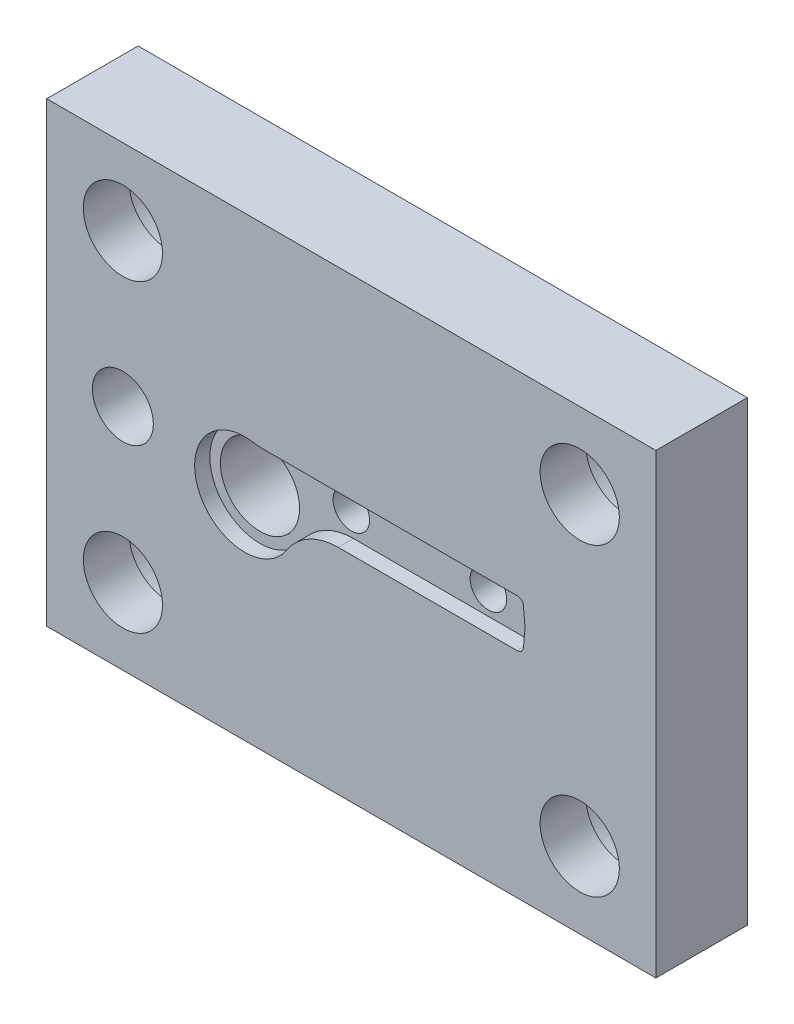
SolidWorks part; units mm, degrees
ref_plane "Plan1" through (0, 0, 0) normal (0, 0, 1) x (1, 0, 0)
ref_plane "Plan2" through (0, 0, 0) normal (0, 1, 0) x (1, 0, 0)
ref_plane "Plan3" through (0, 0, 0) normal (1, 0, 0) x (0, 0, -1)
sketch "Esquisse1" plane through (0, 0, 0) normal (0, 0, 1) x (1, 0, 0)
  line L1 (0, 0) -> (200, 0)
  line L2 (0, 0) -> (0, 150)
  line L3 (0, 150) -> (200, 150)
  line L4 (200, 0) -> (200, 150)
  dimension "D1" = 150
  dimension "D2" = 200
extrude "Base-Extrusion" add sketch "Esquisse1" along normal blind 30
sketch "Esquisse2" plane through (0, 0, 30) normal (0, 0, 1) x (1, 0, 0)
  line L0 (-10, 70) -> (90, 70) construction
  line L1 (0, 0) -> (200, 0) construction
  line L2 (20.3045, 78.12) -> (209.4484, 78.12) construction
  line L3 (71.0782, 85.935) -> (154.4898, 85.935)
  line L4 (156.5121, 84.0819) -> (157.0337, 78.12)
  line L5 (156.5121, 72.1581) -> (157.0337, 78.12)
  line L6 (95.6814, 70.305) -> (154.4898, 70.305)
  line L7 (200, 0) -> (200, 150) construction
  arc A0 (67.7404, 86.2151) -> (78.8329, 61.1069) centre (65, 70) ccw
  arc A1 (154.4898, 85.935) -> (156.5121, 84.0819) centre (154.4898, 83.905) cw
  arc A2 (71.0782, 85.935) -> (67.7404, 86.2151) centre (71.0782, 105.965) cw
  arc A3 (154.4898, 70.305) -> (156.5121, 72.1581) centre (154.4898, 72.335) ccw
  arc A4 (95.6814, 70.305) -> (78.8329, 61.1069) centre (95.6814, 50.275) ccw
  point P13 (156.35, 85.935)
  dimension "D2" = 32.89
  dimension "D6" = 91.35
  dimension "D7" = 2.03
  dimension "D8" = 20.03
  dimension "D9" = 20.03
  dimension "D10" = 135
  dimension "D1" = 70
  dimension "D3" = 8.12
  dimension "D4" = 7.815
  dimension "D5" = 95
extrude "Enlèv. mat.-Extru.1" cut sketch "Esquisse2" against normal blind 5
sketch "Esquisse3" plane through (0, 0, 25) normal (0, 0, 1) x (1, 0, 0)
  circle A0 centre (65, 70) radius 13
  dimension "D1" = 26
extrude "Enlèv. mat.-Extru.2" cut sketch "Esquisse3" against normal through all
sketch "Esquisse6" plane through (0, 0, 25) normal (0, 0, 1) x (1, 0, 0)
  line L0 (177.0279, 78.12) -> (94.3195, 78.12) construction
  line L1 (200, 0) -> (200, 150) construction
  circle A0 centre (140, 78.12) radius 6
  circle A1 centre (95, 78.12) radius 6
  dimension "D1" = 45
  dimension "D2" = 60
  dimension "D3" = 12
  dimension "D4" = 12
extrude "Enlèv. mat.-Extru.5" cut sketch "Esquisse6" against normal blind 13
sketch "Esquisse7" plane through (0, 0, 12) normal (0, 0, 1) x (1, 0, 0)
  circle A0 centre (140, 78.12) radius 9
  circle A1 centre (95, 78.12) radius 9
  dimension "D1" = 18
  dimension "D2" = 18
extrude "Enlèv. mat.-Extru.6" cut sketch "Esquisse7" against normal through all
sketch "Esquisse8" plane through (0, 0, 30) normal (0, 0, 1) x (1, 0, 0)
  line L1 (200, 0) -> (200, 150) construction
  line L2 (0, 0) -> (200, 0) construction
  circle A0 centre (25, 125) radius 13
  circle A1 centre (25, 25) radius 13
  circle A2 centre (175, 25) radius 13
  circle A3 centre (175, 125) radius 13
  dimension "D1" = 26
  dimension "D2" = 26
  dimension "D3" = 26
  dimension "D4" = 26
  dimension "D5" = 150
  dimension "D6" = 25
  dimension "D8" = 150
  dimension "D10" = 100
  dimension "D11" = 100
  dimension "D12" = 25
  dimension "D7" = 25
  dimension "D9" = 25
extrude "Enlèv. mat.-Extru.7" cut sketch "Esquisse8" against normal blind 15
sketch "Esquisse9" plane through (0, 0, 15) normal (0, 0, 1) x (1, 0, 0)
  circle A0 centre (25, 125) radius 20
  circle A1 centre (175, 125) radius 20
  circle A2 centre (175, 25) radius 20
  circle A3 centre (25, 25) radius 20
  dimension "D1" = 40
  dimension "D2" = 40
  dimension "D3" = 40
  dimension "D4" = 40
extrude "Enlèv. mat.-Extru.8" cut sketch "Esquisse9" against normal through all
hole_wizard "Chambrage pour vis à tête hexagonale M41" positions "Esquisse11" profile "Esquisse10" counterbore size "M4" standard "ISO"
sketch "Esquisse11" plane through (0, 0, 30) normal (0, 0, 1) x (1, 0, 0)
  line L0 (0, 150) -> (0, 0) construction
  line L1 (0, 0) -> (200, 0) construction
  point P0 (25, 75)
  dimension "D1" = 25
  dimension "D2" = 75
sketch "Esquisse10" plane through (25, 75, 30) normal (1, 0, 0) x (0, -1, 0)
  line L0 (0, 0) -> (0, 30)
  line L1 (0, 30) -> (6, 30)
  line L3 (6, 30) -> (6, 21.5)
  line L4 (6, 21.5) -> (10, 21.5)
  line L5 (10, 21.5) -> (10, 0)
  line L7 (10, 0) -> (0, 0)
  line L11 (0, -6.35) -> (0, 107.95) construction
  dimension "Diamètre du perçage jusqu'au prochain" = 12
  dimension "Profondeur du perçage jusqu'au prochain" = 30
  dimension "Diamètre du chambrage" = 20
  dimension "Profondeur du chambrage" = 21.5
